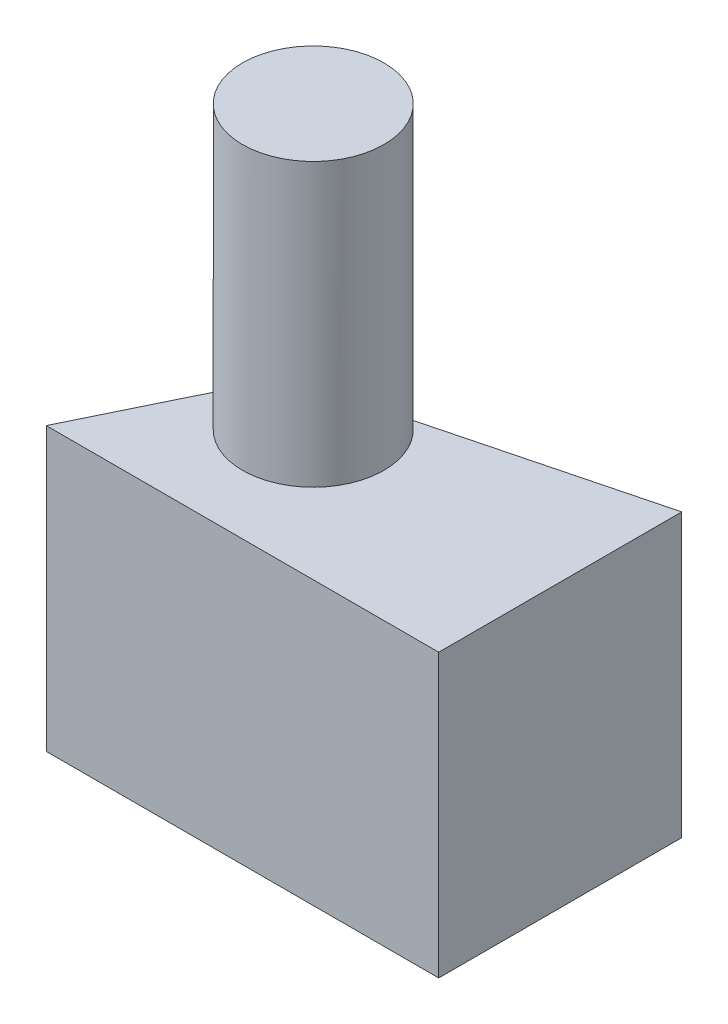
SolidWorks part; units mm, degrees
ref_plane "Piano frontale" through (0, 0, 0) normal (0, 0, 1) x (1, 0, 0)
ref_plane "Piano superiore" through (0, 0, 0) normal (0, 1, 0) x (1, 0, 0)
ref_plane "Piano destro" through (0, 0, 0) normal (1, 0, 0) x (0, 0, -1)
sketch "Schizzo1" plane through (0, 0, 0) normal (0, 1, 0) x (1, 0, 0)
  line L0 (0, 0) -> (2.7912, 5.7446)
  line L1 (0, 0) -> (13.9101, 0)
  line L2 (2.7912, 5.7446) -> (13.9101, 8.6135)
  line L4 (13.9101, 0) -> (13.9101, 8.6135)
extrude "Estrusione-Estrusione1" add sketch "Schizzo1" along normal blind 10
ref_plane "Piano1" through (0, 10, 0) normal (0, 1, 0) x (1, 0, 0)
sketch "Schizzo2" plane through (0, 10, 0) normal (0, 1, 0) x (1, 0, 0)
  circle A0 centre (4.8505, 4.6122) radius 2.5079
extrude "Estrusione-Estrusione2" add sketch "Schizzo2" along normal blind 10
